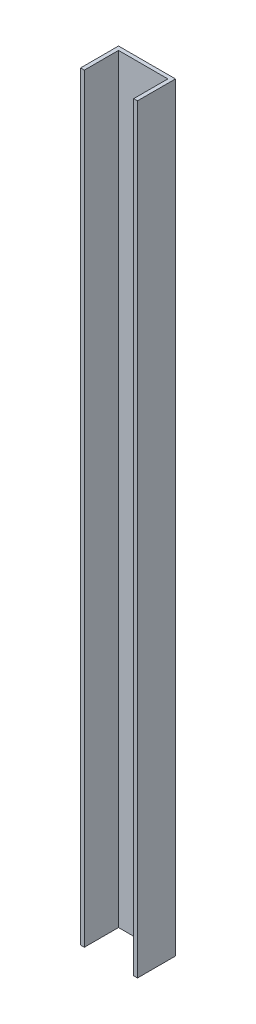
SolidWorks part; units mm, degrees
ref_plane "Front Plane" through (0, 0, 0) normal (0, 0, 1) x (1, 0, 0)
ref_plane "Top Plane" through (0, 0, 0) normal (0, 1, 0) x (1, 0, 0)
ref_plane "Right Plane" through (0, 0, 0) normal (1, 0, 0) x (0, 0, -1)
sketch "Sketch1" plane through (0, 0, 0) normal (0, 0, 1) x (1, 0, 0)
  line L1 (0, 0) -> (15, 0)
  line L2 (0, 0) -> (0, 200)
  line L3 (0, 200) -> (15, 200)
  line L4 (15, 0) -> (15, 200)
  dimension "D1" = 200
  dimension "D2" = 15
extrude "Boss-Extrude3" add sketch "Sketch1" along normal blind 10
sketch "Sketch3" plane through (0, 200, 0) normal (0, 1, 0) x (1, 0, 0)
  line L0 (15, -10) -> (0, -10) construction
  line L1 (1, -10) -> (14, -10)
  line L2 (1, -10) -> (1, -1)
  line L3 (1, -1) -> (14, -1)
  line L4 (14, -10) -> (14, -1)
  line L5 (15, 0) -> (0, 0) construction
  line L6 (0, -10) -> (0, 0) construction
  line L7 (15, -10) -> (15, 0) construction
  dimension "D1" = 1
  dimension "D2" = 1
  dimension "D3" = 1
extrude "Cut-Extrude2" cut sketch "Sketch3" against normal through all
